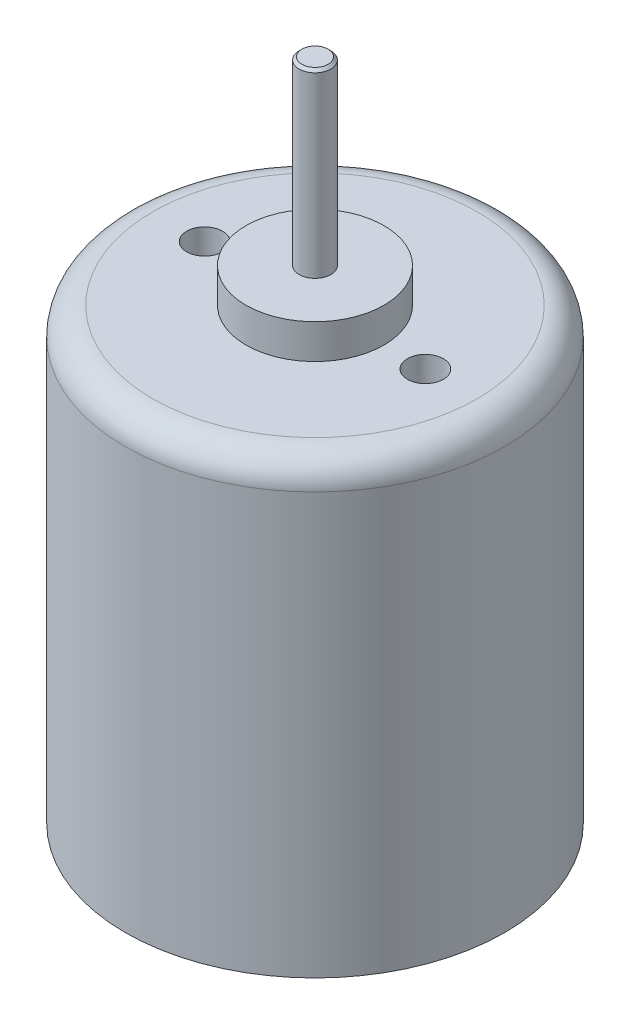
SolidWorks part; units mm, degrees
ref_plane "Front Plane" through (0, 0, 0) normal (0, 0, 1) x (1, 0, 0)
ref_plane "Top Plane" through (0, 0, 0) normal (0, 1, 0) x (1, 0, 0)
ref_plane "Right Plane" through (0, 0, 0) normal (1, 0, 0) x (0, 0, -1)
sketch "Sketch1" plane through (0, 0, 0) normal (0, 1, 0) x (1, 0, 0)
  circle A0 centre (0, 0) radius 13.75
  dimension "D1" = 27.5
extrude "body" add sketch "Sketch1" along normal blind 32.5
ref_plane "Plane1" through (0, 48.1, 0) normal (0, 1, 0) x (-1, 0, 0)
sketch "Sketch2" plane through (0, 48.1, 0) normal (0, 1, 0) x (-1, 0, 0)
  circle A0 centre (0, 0) radius 1.15
  dimension "D1" = 2.3
extrude "shaft" add sketch "Sketch2" against normal blind 51 separate body
sketch "Sketch3" plane through (0, 0, 0) normal (0, -1, 0) x (1, 0, 0)
  circle A0 centre (0, 0) radius 5
  dimension "D1" = 10
extrude "rear bushing" add sketch "Sketch3" along normal blind 2.5 separate body
sketch "Sketch4" plane through (0, 32.5, 0) normal (0, 1, 0) x (1, 0, 0)
  circle A0 centre (0, 0) radius 5
  dimension "D1" = 10
extrude "front bushing" add sketch "Sketch4" along normal blind 2.5 separate body
sketch "Sketch5" plane through (0, 32.5, 0) normal (0, 1, 0) x (1, 0, 0)
  line L0 (-13.75, 0) -> (13.75, 0) construction
  line L1 (0, 13.75) -> (0, -13.75) construction
  circle A0 centre (0, 0) radius 13.75 construction
  circle A1 centre (-8, 0) radius 1.3
  circle A2 centre (8, 0) radius 1.3
  dimension "D1" = 2.6
  dimension "D2" = 16
extrude "mounting holes" cut sketch "Sketch5" against normal blind 5
fillet "body fillet" radius 2 1 edges at (0, 32.5, 13.75)
chamfer "shaft chamfers" distance 0.2 angle 45 2 edges at (0, -2.9, 1.15) (0, 48.1, 1.15)
sketch "centerlines" plane through (0, 32.5, 0) normal (0, 1, 0) x (1, 0, 0)
  line L0 (-11.75, 0) -> (11.75, 0) construction
  circle A0 centre (0, 0) radius 11.75 construction
